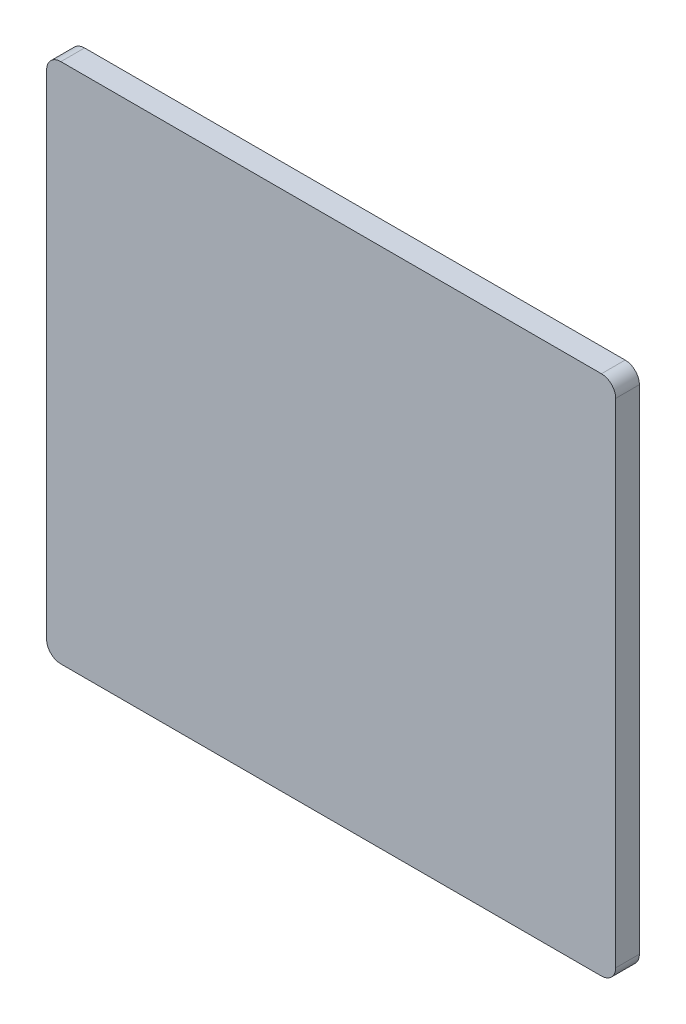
SolidWorks part; units mm, degrees
ref_plane "Front Plane" through (0, 0, 0) normal (0, 0, 1) x (1, 0, 0)
ref_plane "Top Plane" through (0, 0, 0) normal (0, 1, 0) x (1, 0, 0)
ref_plane "Right Plane" through (0, 0, 0) normal (1, 0, 0) x (0, 0, -1)
sketch "Sketch1" plane through (0, 0, 0) normal (0, 0, 1) x (1, 0, 0)
  line L1 (60, -55) -> (-60, -55)
  line L2 (60, -55) -> (60, 55)
  line L3 (60, 55) -> (-60, 55)
  line L4 (-60, -55) -> (-60, 55)
  line L5 (60, -55) -> (-60, 55) construction
  line L6 (60, 55) -> (-60, -55) construction
  point P0 (0, 0)
  dimension "D1" = 110
  dimension "D2" = 120
extrude "Boss-Extrude1" add sketch "Sketch1" along normal mid plane 5
fillet "Fillet1" radius 3 4 edges at (-60, -55, 0) (60, -55, 0) (60, 55, 0) (-60, 55, 0)
